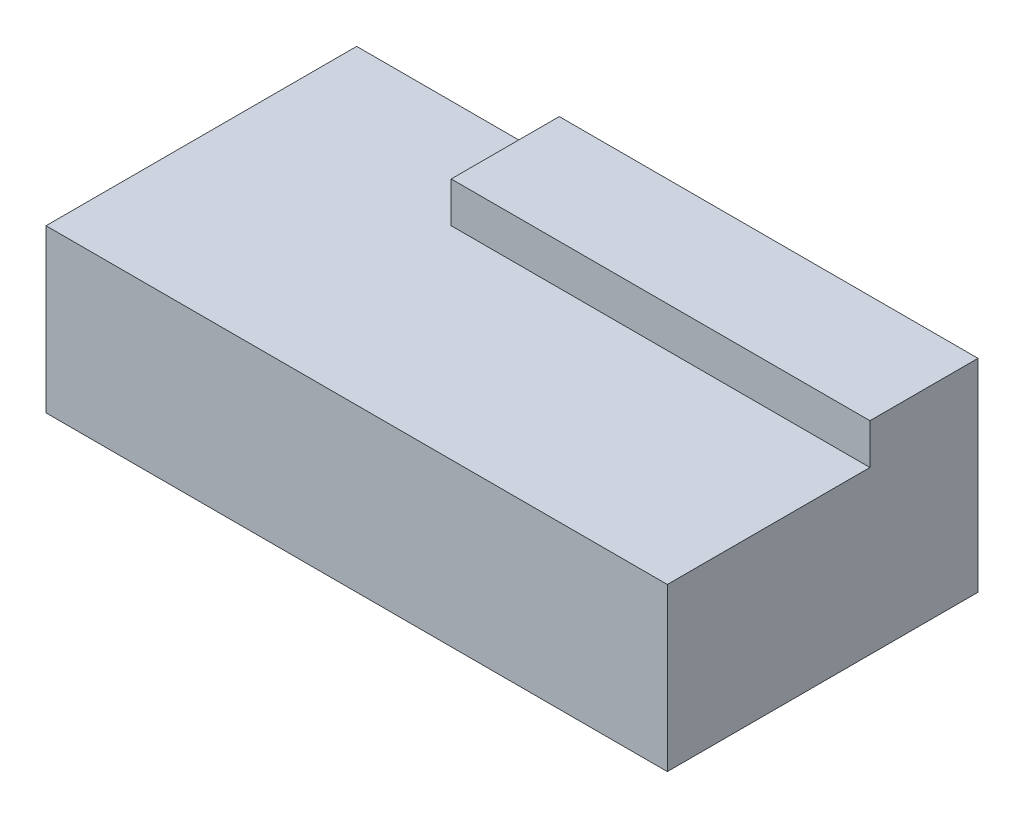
SolidWorks part; units mm, degrees
ref_plane "Front Plane" through (0, 0, 0) normal (0, 0, 1) x (1, 0, 0)
ref_plane "Top Plane" through (0, 0, 0) normal (0, 1, 0) x (1, 0, 0)
ref_plane "Right Plane" through (0, 0, 0) normal (1, 0, 0) x (0, 0, -1)
sketch "Sketch1" plane through (0, 0, 0) normal (0, 1, 0) x (1, 0, 0)
  line L1 (-115, 57.5) -> (115, 57.5)
  line L2 (-115, 57.5) -> (-115, -57.5)
  line L3 (-115, -57.5) -> (115, -57.5)
  line L4 (115, 57.5) -> (115, -57.5)
  line L5 (-115, 57.5) -> (115, -57.5) construction
  line L6 (-115, -57.5) -> (115, 57.5) construction
  point P0 (0, 0)
  dimension "D1" = 230
  dimension "D2" = 115
extrude "Boss-Extrude1" add sketch "Sketch1" along normal mid plane 75
sketch "Sketch2" plane through (0, 37.5, 0) normal (0, 1, 0) x (1, 0, 0)
  line L0 (-115, -57.5) -> (115, -57.5) construction
  line L1 (-115, 57.5) -> (-40, 57.5)
  line L2 (-115, 57.5) -> (-115, -57.5)
  line L3 (-115, -57.5) -> (-40, -57.5)
  line L4 (-40, 57.5) -> (-40, -57.5)
  dimension "D1" = 75
extrude "Cut-Extrude1" cut sketch "Sketch2" against normal blind 15
sketch "Sketch3" plane through (0, 37.5, 0) normal (0, 1, 0) x (1, 0, 0)
  line L0 (115, -57.5) -> (115, 57.5) construction
  line L1 (-40, -57.5) -> (115, -57.5)
  line L2 (-40, -57.5) -> (-40, 17.5)
  line L3 (-40, 17.5) -> (115, 17.5)
  line L4 (115, -57.5) -> (115, 17.5)
  dimension "D1" = 75
extrude "Cut-Extrude2" cut sketch "Sketch3" against normal blind 15
